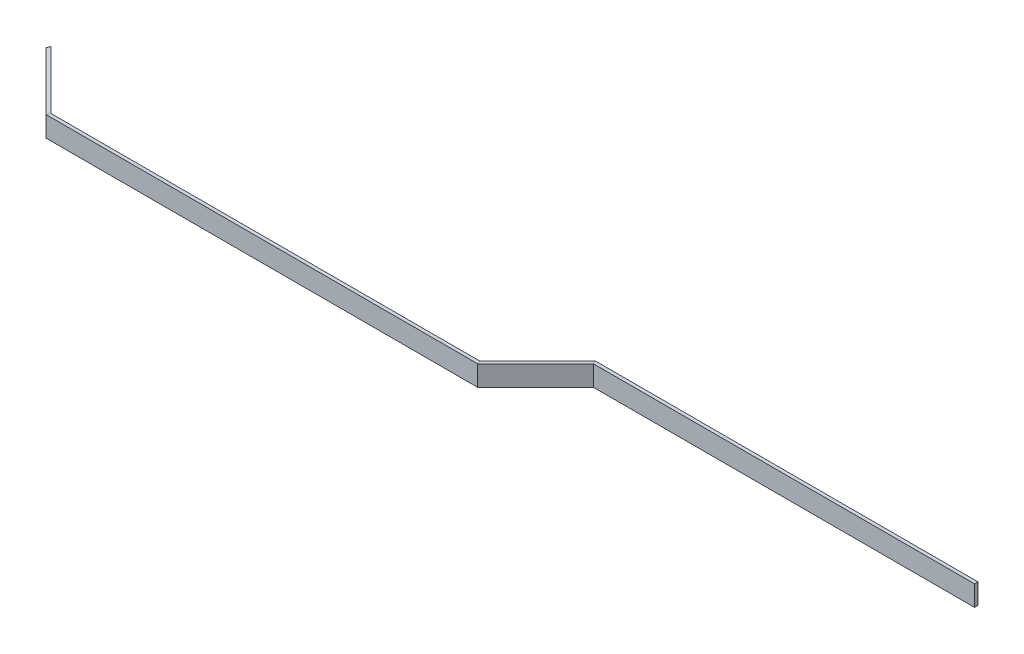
SolidWorks part; units mm, degrees
ref_plane "Front Plane" through (0, 0, 0) normal (0, 0, 1) x (1, 0, 0)
ref_plane "Top Plane" through (0, 0, 0) normal (0, 1, 0) x (1, 0, 0)
ref_plane "Right Plane" through (0, 0, 0) normal (1, 0, 0) x (0, 0, -1)
sketch "Sketch1" plane through (0, 0, 0) normal (0, 1, 0) x (1, 0, 0)
  line L0 (-1219.2, 107.95) -> (-508, 107.95)
  line L1 (-508, 107.95) -> (-400.05, 0)
  line L2 (-400.05, 0) -> (400.05, 0)
  line L3 (400.05, 0) -> (508, 107.95)
  line L4 (508, 107.95) -> (1219.2, 107.95)
  dimension "D1" = 711.2
  dimension "D2" = 152.6644
  dimension "D3" = 45
  dimension "D4" = 2438.4
  dimension "D5" = 800.1
  dimension "D6" = 107.95
ref_plane "Plane4" through (-1219.2, 0, 0) normal (1, 0, 0) x (0, 0, -1)
sketch "Sketch2" plane through (-1219.2, 0, 0) normal (1, 0, 0) x (0, 0, -1)
  line L4 (107.95, 0) -> (0, 0) construction
  line L5 (101.6, 0) -> (107.95, 0)
  line L8 (107.95, -38.1) -> (101.6, -38.1)
  line L10 (101.6, 0) -> (101.6, -38.1)
  line L11 (107.95, 0) -> (107.95, -38.1)
  point P3 (0, 0)
  point P4 (0, 0)
  point P9 (0, 0)
  point P10 (0, 0)
  dimension "D1" = 38.1
  dimension "D2" = 6.35
sweep "Sweep1" add profiles "Sketch2" path "Sketch1"
sketch "Sketch6" plane through (-1219.2, 0, 0) normal (-1, 0, 0) x (0, 0, 1)
  line L4 (-107.95, 0) -> (-107.95, -38.1)
  line L5 (-107.95, -38.1) -> (-101.6, -38.1)
  line L6 (-101.6, -38.1) -> (-101.6, 0)
  line L7 (-101.6, 0) -> (-107.95, 0)
  line L8 (-107.95, 0) -> (-107.95, -38.1)
  line L9 (-107.95, -38.1) -> (-101.6, -38.1)
  line L10 (-101.6, -38.1) -> (-101.6, 0)
  line L11 (-101.6, 0) -> (-107.95, 0)
  dimension "D1" = 0
extrude "Cut-Extrude1" cut sketch "Sketch6" against normal up to vertex (708.5697 mm away)
sketch "Sketch5" plane through (1219.2, 0, 0) normal (1, 0, 0) x (0, 0, -1)
  line L3 (107.95, -38.1) -> (107.95, 0)
  line L4 (107.95, 0) -> (101.6, 0)
  line L5 (101.6, 0) -> (101.6, -38.1)
  line L6 (107.95, -38.1) -> (107.95, 0)
  line L7 (107.95, 0) -> (101.6, 0)
  line L8 (101.6, 0) -> (101.6, -38.1)
  line L10 (101.6, -38.1) -> (107.95, -38.1)
  line L11 (101.6, -38.1) -> (107.95, -38.1)
  dimension "D1" = 0
extrude "Boss-Extrude2" add sketch "Sketch5" along normal blind 2.54
sketch "Sketch7" plane through (0, -38.1, 0) normal (0, -1, 0) x (1, 0, 0)
  line L0 (-510.6303, -101.6) -> (-508, -107.95)
  line L1 (-508, -107.95) -> (-510.6303, -107.95)
  line L2 (-510.6303, -107.95) -> (-510.6303, -101.6)
extrude "Cut-Extrude3" cut sketch "Sketch7" against normal through all contours L2 L0 L1
